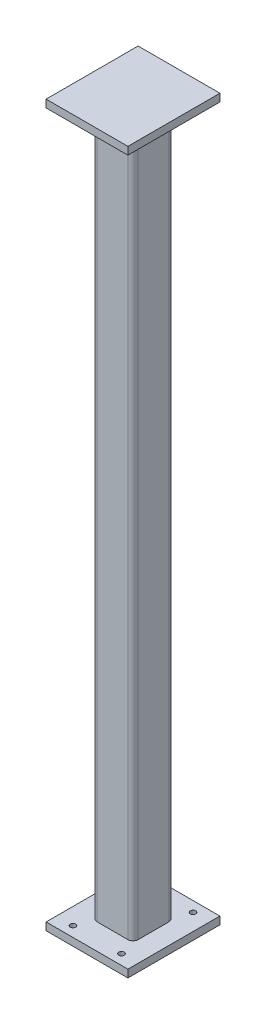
SolidWorks part; units mm, degrees
ref_plane "Front" through (0, 0, 0) normal (0, 0, 1) x (1, 0, 0)
ref_plane "Top" through (0, 0, 0) normal (0, 1, 0) x (1, 0, 0)
ref_plane "Right" through (0, 0, 0) normal (1, 0, 0) x (0, 0, -1)
sketch "Sketch1" plane through (0, 0, 0) normal (0, 1, 0) x (1, 0, 0)
  line L1 (-50.8, -57.15) -> (50.8, -57.15)
  line L2 (-50.8, -57.15) -> (-50.8, 57.15)
  line L3 (-50.8, 57.15) -> (50.8, 57.15)
  line L4 (50.8, -57.15) -> (50.8, 57.15)
  line L5 (-50.8, -57.15) -> (50.8, 57.15) construction
  line L6 (-50.8, 57.15) -> (50.8, -57.15) construction
  point P0 (0, 0)
  dimension "D1" = 114.3
  dimension "D2" = 101.6
extrude "Boss-Extrude1" add sketch "Sketch1" along normal blind 9.525
sketch "Sketch2" plane through (0, 9.525, 0) normal (0, 1, 0) x (1, 0, 0)
  line L1 (-25.4, -25.4) -> (25.4, -25.4)
  line L2 (-25.4, -25.4) -> (-25.4, 25.4)
  line L3 (-25.4, 25.4) -> (25.4, 25.4)
  line L4 (25.4, -25.4) -> (25.4, 25.4)
  line L5 (-25.4, -25.4) -> (25.4, 25.4) construction
  line L6 (-25.4, 25.4) -> (25.4, -25.4) construction
  point P0 (0, 0)
  dimension "D1" = 50.8
extrude "Boss-Extrude2" add sketch "Sketch2" along normal blind 875.8327
sketch "Sketch3" plane through (0, 885.3577, 0) normal (0, 1, 0) x (1, 0, 0)
  line L1 (-50.8, -57.15) -> (50.8, -57.15)
  line L2 (-50.8, -57.15) -> (-50.8, 57.15)
  line L3 (-50.8, 57.15) -> (50.8, 57.15)
  line L4 (50.8, -57.15) -> (50.8, 57.15)
  line L5 (-50.8, -57.15) -> (50.8, 57.15) construction
  line L6 (-50.8, 57.15) -> (50.8, -57.15) construction
  point P0 (0, 0)
  dimension "D1" = 114.3
  dimension "D2" = 101.6
extrude "Boss-Extrude3" add sketch "Sketch3" along normal blind 9.525
fillet "Fillet1" radius 6.35 4 edges at (-25.4, 447.4413, 25.4) (-25.4, 447.4413, -25.4) (25.4, 447.4413, -25.4) (25.4, 447.4413, 25.4)
hole_wizard "1/4 Clearance Hole1" positions "Sketch5" profile "Sketch4" hole size "1/4" standard "Ansi Inch"
sketch "Sketch5" plane through (0, 9.525, 0) normal (0, 1, 0) x (-1, 0, 0)
  line L0 (30.1625, 44.45) -> (-30.1625, -44.45) construction
  point P0 (-30.1625, 44.45)
  point P1 (-30.1625, -44.45)
  point P3 (30.1625, -44.45)
  point P5 (30.1625, 44.45)
  dimension "D1" = 60.325
  dimension "D2" = 88.9
sketch "Sketch4" plane through (30.1625, 9.525, 44.45) normal (1, 0, 0) x (0, 0, 1)
  line L0 (0, 0) -> (0, 9.525)
  line L1 (0, 9.525) -> (3.3782, 9.525)
  line L2 (3.3782, 9.525) -> (3.3782, 0)
  line L5 (3.3782, 0) -> (0, 0)
  line L11 (0, -6.35) -> (0, 107.95) construction
  dimension "Thru Hole Dia." = 6.7564
  dimension "Thru Hole Depth" = 9.525
